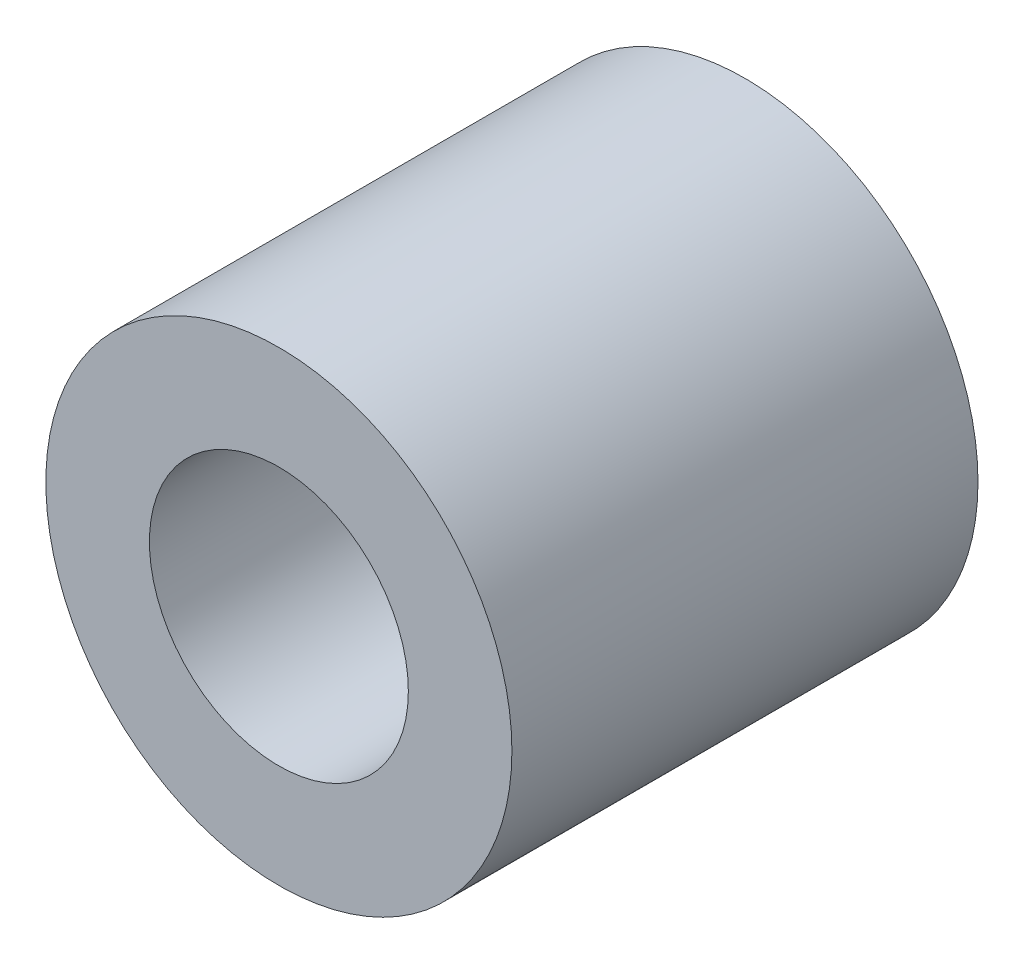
SolidWorks part; units mm, degrees
ref_plane "Plane1" through (0, 0, 0) normal (0, 0, 1) x (1, 0, 0)
ref_plane "Plane2" through (0, 0, 0) normal (0, 1, 0) x (1, 0, 0)
ref_plane "Plane3" through (0, 0, 0) normal (1, 0, 0) x (0, 0, -1)
sketch "Sketch1" plane through (0, 0, 0) normal (0, 0, 1) x (1, 0, 0)
  circle A0 centre (0, 0) radius 4.5
  dimension "D1" = 9
extrude "insert shape" add sketch "Sketch1" along normal blind 9
sketch "Sketch2" plane through (0, 0, 9) normal (0, 0, 1) x (1, 0, 0)
  line L0 (0, 0) -> (0, 5.7005) construction
  line L1 (-0.05, 4.4997) -> (0, 4.5997)
  line L2 (0.05, 4.4997) -> (0, 4.5997)
  line L3 (-0.05, 4.4997) -> (0.05, 4.4997)
  circle A0 centre (0, 0) radius 4.5 construction
  dimension "D1" = 0.1
  dimension "D2" = 0.1
extrude "grip ribs" [suppressed] add sketch "Sketch2" along normal up to surface (9 mm away)
pattern_circular "copy grip ribs" [suppressed] count 24 every 15
sketch "Sketch3" plane through (0, 0, 9) normal (0, 0, 1) x (1, 0, 0)
  circle A0 centre (0, 0) radius 2.5
  dimension "D1" = 5
extrude "center hole" cut sketch "Sketch3" against normal blind 4.3
sketch "Sketch4" plane through (0, 0, 4.7) normal (0, 0, 1) x (1, 0, 0)
  circle A0 centre (0, 0) radius 1.75
  dimension "D1" = 3.5
extrude "tapped hole" cut sketch "Sketch4" against normal up to next
